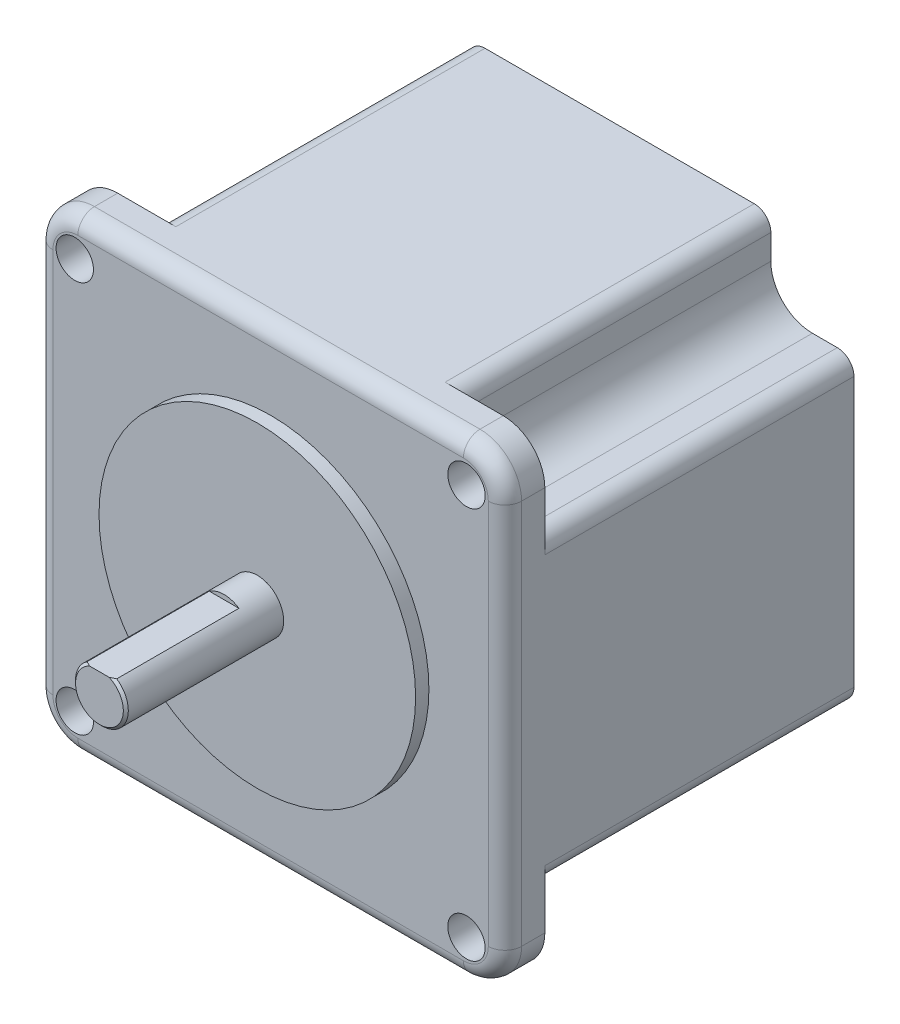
SolidWorks part; units mm, degrees
ref_plane "前视基准面" through (0, 0, 0) normal (0, 0, 1) x (1, 0, 0)
ref_plane "上视基准面" through (0, 0, 0) normal (0, 1, 0) x (1, 0, 0)
ref_plane "右视基准面" through (0, 0, 0) normal (1, 0, 0) x (0, 0, -1)
sketch "草图1" plane through (0, 0, 0) normal (0, 0, 1) x (1, 0, 0)
  circle A0 centre (0, 0) radius 19.05
extrude "凸台-拉伸1" add sketch "草图1" against normal blind 1.6
sketch "草图2" plane through (0, 0, 0) normal (0, 0, 1) x (1, 0, 0)
  circle A0 centre (0, 0) radius 3.175
extrude "凸台-拉伸2" add sketch "草图2" along normal blind 19
sketch "草图3" plane through (0, 0, 19) normal (0, 0, 1) x (1, 0, 0)
  line L1 (0, 2.625) -> (3.175, 2.625)
  line L2 (3.175, 2.625) -> (3.175, 4.8716)
  line L3 (3.175, 4.8716) -> (-4.5007, 4.8716)
  line L4 (-4.5007, 4.8716) -> (-4.5007, 2.625)
  line L5 (-4.5007, 2.625) -> (0, 2.625)
extrude "切除-拉伸1" cut sketch "草图3" against normal blind 15
sketch "草图4" plane through (0, 0, -1.6) normal (0, 0, -1) x (-1, 0, 0)
  line L1 (0, 28.2) -> (23.2, 28.2)
  line L2 (28.2, 23.2) -> (28.2, -23.2)
  line L3 (23.2, -28.2) -> (-23.2, -28.2)
  line L4 (-28.2, -23.2) -> (-28.2, 23.2)
  line L5 (-23.2, 28.2) -> (0, 28.2)
  arc A0 (-23.2, -28.2) -> (-28.2, -23.2) centre (-23.2, -23.2) cw
  arc A1 (28.2, -23.2) -> (23.2, -28.2) centre (23.2, -23.2) cw
  arc A2 (23.2, 28.2) -> (28.2, 23.2) centre (23.2, 23.2) cw
  arc A3 (-28.2, 23.2) -> (-23.2, 28.2) centre (-23.2, 23.2) cw
  dimension "D1" = 5
extrude "凸台-拉伸3" add sketch "草图4" along normal blind 42
fillet "圆角1" radius 2 8 edges at (0, -28.2, -1.6) (-26.7355, -26.7355, -1.6) (-28.2, 0, -1.6) (-26.7355, 26.7355, -1.6) (0, 28.2, -1.6) (26.7355, 26.7355, -1.6) (28.2, 0, -1.6) (26.7355, -26.7355, -1.6)
sketch "草图7" plane through (0, 0, -43.6) normal (0, 0, -1) x (-1, 0, 0)
  line L1 (23.2, 28.2) -> (-23.2, 28.2) construction
  line L2 (10.121, 28.2) -> (16.2, 28.2)
  line L3 (18.2, 26.2) -> (18.2, 23.2)
  line L4 (23.2, 18.2) -> (26.2, 18.2)
  line L5 (28.2, 16.2) -> (28.2, 11.6043)
  line L6 (28.2, -23.2) -> (28.2, 23.2) construction
  line L7 (28.2, 11.6043) -> (36.3869, 11.6043)
  line L8 (36.3869, 11.6043) -> (36.3869, 38.6494)
  line L9 (36.3869, 38.6494) -> (10.121, 38.6494)
  line L10 (10.121, 38.6494) -> (10.121, 28.2)
  line L12 (-10.121, 38.6494) -> (-10.121, 28.2)
  line L13 (-36.3869, 38.6494) -> (-10.121, 38.6494)
  line L14 (-36.3869, 11.6043) -> (-36.3869, 38.6494)
  line L15 (-28.2, 11.6043) -> (-36.3869, 11.6043)
  line L16 (-28.2, 16.2) -> (-28.2, 11.6043)
  line L17 (-23.2, 18.2) -> (-26.2, 18.2)
  line L18 (-18.2, 26.2) -> (-18.2, 23.2)
  line L19 (-10.121, 28.2) -> (-16.2, 28.2)
  line L20 (10.121, -38.6494) -> (10.121, -28.2)
  line L21 (36.3869, -38.6494) -> (10.121, -38.6494)
  line L22 (36.3869, -11.6043) -> (36.3869, -38.6494)
  line L23 (28.2, -11.6043) -> (36.3869, -11.6043)
  line L24 (28.2, -16.2) -> (28.2, -11.6043)
  line L25 (23.2, -18.2) -> (26.2, -18.2)
  line L26 (18.2, -26.2) -> (18.2, -23.2)
  line L27 (10.121, -28.2) -> (16.2, -28.2)
  line L28 (-10.121, -28.2) -> (-16.2, -28.2)
  line L29 (-18.2, -26.2) -> (-18.2, -23.2)
  line L30 (-23.2, -18.2) -> (-26.2, -18.2)
  line L31 (-28.2, -16.2) -> (-28.2, -11.6043)
  line L32 (-28.2, -11.6043) -> (-36.3869, -11.6043)
  line L33 (-36.3869, -11.6043) -> (-36.3869, -38.6494)
  line L34 (-36.3869, -38.6494) -> (-10.121, -38.6494)
  line L35 (-10.121, -38.6494) -> (-10.121, -28.2)
  arc A0 (26.2, 18.2) -> (28.2, 16.2) centre (26.2, 16.2) cw
  arc A1 (16.2, 28.2) -> (18.2, 26.2) centre (16.2, 26.2) cw
  arc A2 (18.2, 23.2) -> (23.2, 18.2) centre (23.2, 23.2) ccw
  arc A3 (-18.2, 23.2) -> (-23.2, 18.2) centre (-23.2, 23.2) cw
  arc A4 (-16.2, 28.2) -> (-18.2, 26.2) centre (-16.2, 26.2) ccw
  arc A5 (-26.2, 18.2) -> (-28.2, 16.2) centre (-26.2, 16.2) ccw
  arc A6 (18.2, -23.2) -> (23.2, -18.2) centre (23.2, -23.2) cw
  arc A7 (16.2, -28.2) -> (18.2, -26.2) centre (16.2, -26.2) ccw
  arc A8 (26.2, -18.2) -> (28.2, -16.2) centre (26.2, -16.2) ccw
  arc A9 (-26.2, -18.2) -> (-28.2, -16.2) centre (-26.2, -16.2) cw
  arc A10 (-16.2, -28.2) -> (-18.2, -26.2) centre (-16.2, -26.2) cw
  arc A11 (-18.2, -23.2) -> (-23.2, -18.2) centre (-23.2, -23.2) ccw
  point P20 (18.2, 28.2)
  point P37 (-18.2, 28.2)
  point P52 (18.2, -28.2)
  point P67 (-18.2, -28.2)
  dimension "D1" = 2
  dimension "D2" = 5
extrude "切除-拉伸2" cut sketch "草图7" against normal blind 37.2
sketch "草图8" plane through (0, 0, -1.6) normal (0, 0, 1) x (1, 0, 0)
  point P8 (-23.57, 23.57)
  point P9 (23.57, 23.57)
  point P10 (23.57, -23.57)
  point P11 (-23.57, -23.57)
sketch "草图9" plane through (0, 0, -1.6) normal (0, 0, 1) x (1, 0, 0)
  circle A0 centre (-23.57, 23.57) radius 2.25
  circle A1 centre (23.57, 23.57) radius 2.25
  circle A2 centre (23.57, -23.57) radius 2.25
  circle A3 centre (-23.57, -23.57) radius 2.25
extrude "切除-拉伸3" cut sketch "草图9" against normal blind 37.2
chamfer "倒角1" distance 0.3 angle 45 1 edges at (0, -3.175, 19)
